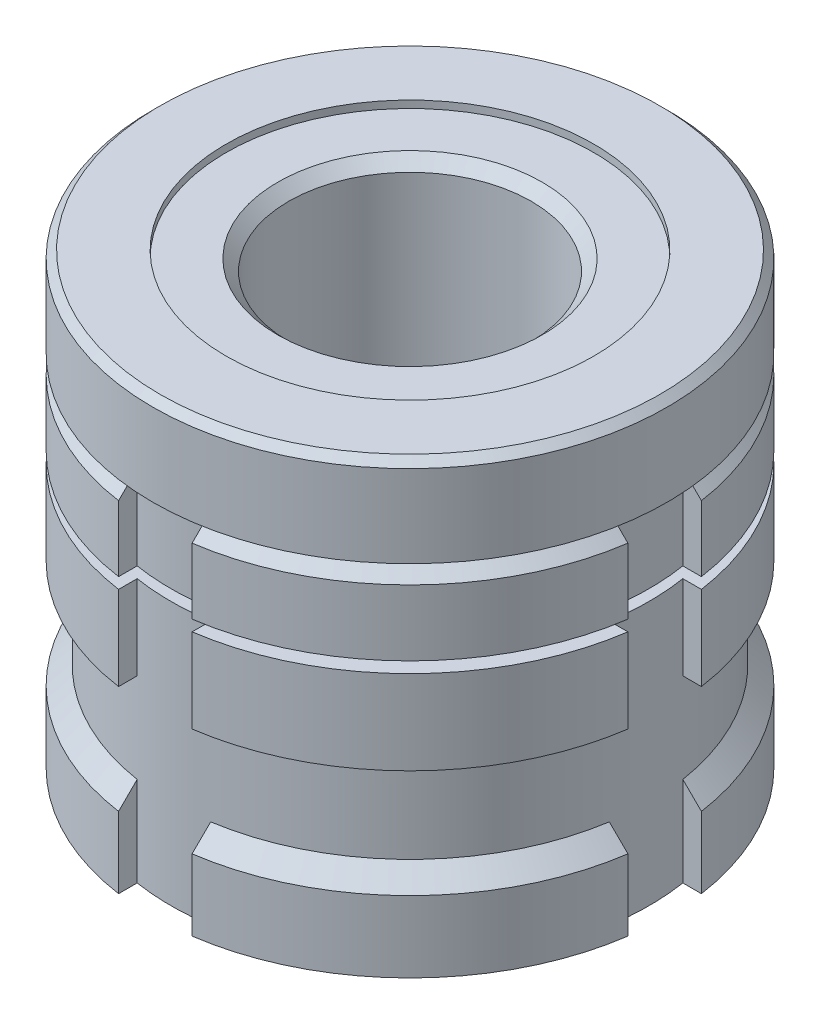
SolidWorks part; units mm, degrees
ref_plane "Front Plane" through (0, 0, 0) normal (0, 0, 1) x (1, 0, 0)
ref_plane "Top Plane" through (0, 0, 0) normal (0, 1, 0) x (1, 0, 0)
ref_plane "Right Plane" through (0, 0, 0) normal (1, 0, 0) x (0, 0, -1)
sketch "Sketch1" plane through (0, 0, 0) normal (0, 1, 0) x (1, 0, 0)
  circle A0 centre (0, 0) radius 35
  dimension "D1" = 70
extrude "Boss-Extrude1" add sketch "Sketch1" along normal blind 24.4
sketch "Sketch2" plane through (0, 0, 0) normal (1, 0, 0) x (0, 0, -1)
  line L0 (0, 13.2648) -> (0, -2.3994) construction
  line L1 (-35, 0) -> (35, 0) construction
  line L2 (-35, 12.95) -> (-25, 12.95)
  line L3 (-35, 12.95) -> (-35, 11.45)
  line L4 (-35, 11.45) -> (-25, 11.45)
  line L5 (-25, 12.95) -> (-25, 11.45)
  line L6 (-35, 12.95) -> (-25, 11.45) construction
  line L7 (-35, 11.45) -> (-25, 12.95) construction
  point P3 (-30, 12.2)
  point P8 (-35, 12.2)
  dimension "D1" = 1.5
  dimension "D2" = 35
  dimension "D3" = 25
  dimension "D4" = 12.2
revolve "Cut-Revolve1" cut sketch "Sketch2" angle 360 about L0
sketch "Sketch3" plane through (0, 0, 0) normal (0, -1, 0) x (1, 0, 0)
  circle A0 centre (0, 0) radius 32.5
  dimension "D1" = 65
extrude "Boss-Extrude2" add sketch "Sketch3" along normal blind 24.4
sketch "Sketch4" plane through (0, -24.4, 0) normal (0, -1, 0) x (1, 0, 0)
  circle A0 centre (0, 0) radius 35
  circle A1 centre (0, 0) radius 35 construction
extrude "Boss-Extrude3" add sketch "Sketch4" against normal blind 12.2
sketch "Sketch5" plane through (0, 24.4, 0) normal (0, 1, 0) x (1, 0, 0)
  line L0 (-34.641, 5) -> (-32.1131, 5)
  line L2 (-32.1131, -5) -> (-34.641, -5)
  line L3 (-5, 34.641) -> (-5, 32.1131)
  line L5 (5, 32.1131) -> (5, 34.641)
  line L6 (32.1131, 5) -> (34.641, 5)
  line L8 (34.641, -5) -> (32.1131, -5)
  line L9 (-5, -32.1131) -> (-5, -34.641)
  line L11 (5, -34.641) -> (5, -32.1131)
  arc A0 (-32.1131, 5) -> (-32.1131, -5) centre (0, 0) ccw
  circle A1 centre (0, 0) radius 32.5 construction
  arc A2 (-34.641, 5) -> (-34.641, -5) centre (0, 0) ccw
  circle A3 centre (0, 0) radius 35 construction
  arc A4 (-5, -32.1131) -> (5, -32.1131) centre (0, 0) ccw
  arc A5 (-5, -34.641) -> (5, -34.641) centre (0, 0) ccw
  arc A6 (32.1131, -5) -> (32.1131, 5) centre (0, 0) ccw
  arc A7 (34.641, -5) -> (34.641, 5) centre (0, 0) ccw
  arc A8 (5, 32.1131) -> (-5, 32.1131) centre (0, 0) ccw
  arc A9 (5, 34.641) -> (-5, 34.641) centre (0, 0) ccw
  point P1 (-35, 0)
  point P5 (-32.5, 0)
  point P25 (0, 0)
  dimension "D1" = 10
extrude "Cut-Extrude4" cut sketch "Sketch5" against normal up to surface (48.8 mm away)
chamfer "Chamfer1" distance 2.5 angle 45 8 edges at (-24.7487, -12.2, -24.7487) (24.7487, -12.2, -24.7487) (-24.7487, 24.4, -24.7487) (24.7487, 24.4, -24.7487) (24.7487, 24.4, 24.7487) (24.7487, -12.2, 24.7487) (-24.7487, -12.2, 24.7487) (-24.7487, 24.4, 24.7487)
sketch "Sketch6" plane through (0, 24.4, 0) normal (0, 1, 0) x (1, 0, 0)
  circle A0 centre (0, 0) radius 35
  arc A1 (5, -34.641) -> (34.641, -5) centre (0, 0) ccw construction
extrude "Boss-Extrude4" add sketch "Sketch6" along normal blind 12.2
chamfer "Chamfer2" distance 1 angle 45 1 edges at (0, 36.6, 35)
sketch "Sketch7" plane through (0, 36.6, 0) normal (0, 1, 0) x (1, 0, 0)
  circle A0 centre (0, 0) radius 25
  dimension "D1" = 50
extrude "Cut-Extrude5" cut sketch "Sketch7" against normal blind 1
sketch "Sketch8" plane through (0, 35.6, 0) normal (0, 1, 0) x (1, 0, 0)
  circle A0 centre (0, 0) radius 16.5
  dimension "D1" = 33
extrude "Cut-Extrude6" cut sketch "Sketch8" against normal up to surface (60 mm away)
chamfer "Chamfer3" distance 1.5 angle 45 2 edges at (0, 35.6, 16.5) (0, -24.4, -16.5)
